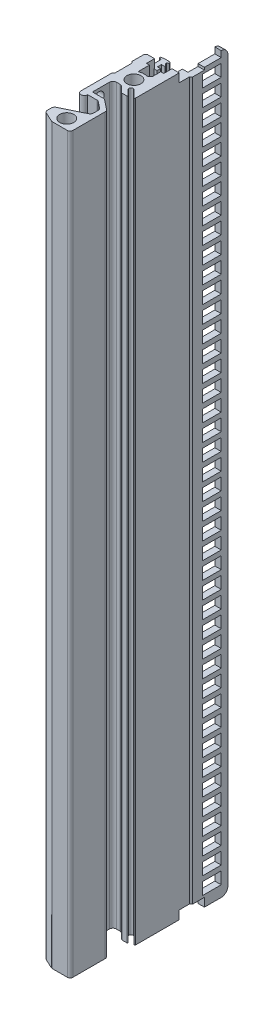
SolidWorks part; units mm, degrees
ref_plane "前视基准面" through (0, 0, 0) normal (0, 0, 1) x (1, 0, 0)
ref_plane "上视基准面" through (0, 0, 0) normal (0, 1, 0) x (1, 0, 0)
ref_plane "右视基准面" through (0, 0, 0) normal (1, 0, 0) x (0, 0, -1)
sketch "草图1" plane through (0, 0, 0) normal (0, 1, 0) x (1, 0, 0)
  line L0 (-4.2, 11.9) -> (-3.9, 11.9)
  line L1 (-4.4, 12.2) -> (-4.4, 12.1)
  line L2 (-4.0328, 12.4) -> (-4.2, 12.4)
  line L3 (-3.85, 12.5) -> (-3.8914, 12.4586)
  line L4 (-2.05, 12.5) -> (-3.85, 12.5)
  line L5 (-2.0086, 12.4586) -> (-2.05, 12.5)
  line L6 (-1.7, 12.4) -> (-1.8672, 12.4)
  line L7 (-1.5, 12.1) -> (-1.5, 12.2)
  line L8 (-1.8, 11.9) -> (-1.7, 11.9)
  line L9 (-2, 11.4828) -> (-2, 11.7)
  line L10 (-1.3586, 10.7586) -> (-1.9414, 11.3414)
  line L11 (-1.3, 10.55) -> (-1.3, 10.6172)
  line L12 (-3.7, 11.7) -> (-3.7, 9.95)
  line L13 (-5, -10.75) -> (-5, -1.6)
  line L14 (-3, -9.35) -> (-3, -5.75)
  line L16 (1.6887, -3.3855) -> (3.2118, -4.9086)
  line L17 (2.5373, -2.537) -> (4.6586, -4.6583)
  line L18 (5, 15) -> (5, 5.1793)
  line L19 (3.6, 15) -> (5, 15)
  line L20 (3.6, 12.5) -> (3.6, 15)
  line L21 (1.95, 12.5) -> (3.6, 12.5)
  line L22 (1.95, 10.55) -> (1.95, 12.5)
  line L23 (2.85, 10.55) -> (1.95, 10.55)
  line L24 (2.85, 9.35) -> (2.85, 10.55)
  line L25 (1.95, 9.35) -> (2.85, 9.35)
  line L26 (1.95, 8.35) -> (1.95, 9.35)
  line L27 (2.85, 8.35) -> (1.95, 8.35)
  line L28 (2.85, 6.05) -> (2.85, 8.35)
  line L29 (1.95, 6.05) -> (2.85, 6.05)
  line L30 (1.95, 3.8856) -> (1.95, 6.05)
  line L31 (-1.45, 6.05) -> (-1.45, 2.9458)
  line L32 (-2.35, 6.05) -> (-1.45, 6.05)
  line L33 (-2.35, 8.35) -> (-2.35, 6.05)
  line L34 (-1.45, 8.35) -> (-2.35, 8.35)
  line L35 (-1.45, 9.35) -> (-1.45, 8.35)
  line L36 (-2.35, 9.35) -> (-1.45, 9.35)
  line L37 (-2.35, 10.55) -> (-2.35, 9.35)
  line L38 (-1.3, 10.55) -> (-2.35, 10.55)
  line L39 (-4.45, 7.7) -> (-4.7, 7.7)
  line L40 (-5, 7.4) -> (-4.7, 7.7)
  line L41 (-5, 4.4) -> (-5, 7.4)
  line L42 (-4.5499, 3.8998) -> (-5, 4.4)
  line L43 (-4.45, 7.7) -> (-4.45, 9.55)
  line L44 (-3.9, 9.75) -> (-4.25, 9.75)
  line L45 (-4.5499, 3.8998) -> (-4.5501, -1.1002)
  line L46 (-5, -1.6) -> (-4.5501, -1.1002)
  line L47 (4.9414, -1.9395) -> (4.6464, -1.6446) construction
  line L48 (5, -2.081) -> (5, -4.5169)
  line L49 (0, 0) -> (0, -5) construction
  line L50 (4.5, -1.291) -> (4.5, 4.3894) construction
  line L53 (-2.5, -5.25) -> (3.0703, -5.25)
  line L54 (2.5373, -2.537) -> (1.6887, -3.3855) construction
  line L55 (5, 5.1793) -> (5, -2.081)
  line L58 (4.9414, 5.0379) -> (4.6464, 4.743) construction
  line L121 (-3, -9.35) -> (4, -9.35)
  line L122 (-4.2, -17.25) -> (2.6, -17.25)
  line L123 (-5, -22.2) -> (-5, -18.05)
  line L124 (-3, -10.75) -> (2.6, -10.75)
  line L125 (4, -9.35) -> (4, -22.2)
  line L126 (3.2, -23) -> (-4.2, -23)
  line L127 (2.6, -10.75) -> (2.6, -17.25)
  circle A0 centre (0, 0) radius 1.6
  arc A1 (-4.4, 12.1) -> (-4.2, 11.9) centre (-4.2, 12.1) ccw
  arc A2 (-4.2, 12.4) -> (-4.4, 12.2) centre (-4.2, 12.2) ccw
  arc A3 (-4.0328, 12.4) -> (-3.8914, 12.4586) centre (-4.0328, 12.6) ccw
  arc A4 (-2.0086, 12.4586) -> (-1.8672, 12.4) centre (-1.8672, 12.6) ccw
  arc A5 (-1.5, 12.2) -> (-1.7, 12.4) centre (-1.7, 12.2) ccw
  arc A6 (-1.7, 11.9) -> (-1.5, 12.1) centre (-1.7, 12.1) ccw
  arc A7 (-1.8, 11.9) -> (-2, 11.7) centre (-1.8, 11.7) ccw
  arc A8 (-2, 11.4828) -> (-1.9414, 11.3414) centre (-1.8, 11.4828) ccw
  arc A9 (-1.3, 10.6172) -> (-1.3586, 10.7586) centre (-1.5, 10.6172) ccw
  arc A11 (3.0703, -5.25) -> (3.2118, -4.9086) centre (3.0703, -5.05) ccw
  arc A12 (-4.25, 9.75) -> (-4.45, 9.55) centre (-4.25, 9.55) ccw
  arc A13 (-3.9, 9.75) -> (-3.7, 9.95) centre (-3.9, 9.95) ccw
  arc A14 (5, -2.081) -> (4.9414, -1.9395) centre (4.8, -2.081) ccw construction
  arc A15 (4.9414, 5.0379) -> (5, 5.1793) centre (4.8, 5.1793) ccw construction
  arc A16 (4.6586, -4.6583) -> (5, -4.5169) centre (4.8, -4.5169) ccw
  arc A17 (2.5373, -2.537) -> (1.6887, -3.3855) centre (2.113, -2.9613) ccw
  arc A18 (0.7125, 2.9142) -> (-1.1719, 2.7616) centre (0, 0) ccw
  arc A19 (-1.45, 2.9458) -> (-1.1719, 2.7616) centre (-1.25, 2.9458) ccw
  arc A20 (0.7125, 2.9142) -> (1.95, 3.8856) centre (0.95, 3.8856) ccw
  arc A21 (-3.7, 11.7) -> (-3.9, 11.9) centre (-3.9, 11.7) ccw
  arc A22 (4.6464, -1.6446) -> (4.5, -1.291) centre (5, -1.291) cw construction
  arc A23 (4.5, 4.3894) -> (4.6464, 4.743) centre (5, 4.3894) cw construction
  arc A29 (-3, -5.75) -> (-2.5, -5.25) centre (-2.5, -5.75) cw
  arc A60 (-5, -22.2) -> (-4.2, -23) centre (-4.2, -22.2) ccw
  circle A61 centre (0, -20) radius 1.6
  arc A62 (-4.2, -17.25) -> (-5, -18.05) centre (-4.2, -18.05) ccw
  arc A63 (-5, -10.75) -> (-3, -10.75) centre (-4, -10.75) ccw
  arc A64 (3.2, -23) -> (4, -22.2) centre (3.2, -22.2) ccw
  dimension "D1" = 3.2
  dimension "D3" = 5.2
  dimension "D4" = 45
  dimension "D5" = 1.2
  dimension "D7" = 0.6
  dimension "D8" = 0.2
  dimension "D10" = 4.1
  dimension "D11" = 1.4
  dimension "D12" = 0.5
  dimension "D13" = 0.5
  dimension "D14" = 1
  dimension "D33" = 3.2
  dimension "D34" = 20
  dimension "D37" = 0.8
  dimension "D38" = 0.8
  dimension "D39" = 0.8
  dimension "D6" = 3
  dimension "D9" = 2.1225
  dimension "D28" = 38
  dimension "D29" = 13.65
  dimension "D30" = 1
  dimension "D31" = 9
  dimension "D32" = 5.75
  dimension "D36" = 6.5
extrude "凸台-拉伸1" add sketch "草图1" along normal mid plane 218.44
sketch "草图6" plane through (0, 109.22, 0) normal (0, 1, 0) x (1, 0, 0)
  line L0 (3.6, 12.5) -> (3.6, 22.5)
  line L1 (3.6, 22.5) -> (5.5, 22.5)
  line L2 (5.5, 22.5) -> (5.5, 12)
  line L3 (5.5, 12) -> (5, 11.5)
  line L4 (3.6, 12.5) -> (5, 11.5)
  line L5 (5, -4.5169) -> (5, 15) construction
  line L6 (-5, 7.4) -> (-5, 4.4) construction
  dimension "D4" = 11
  dimension "D1" = 10.5
  dimension "D2" = 10
  dimension "D3" = 45
extrude "凸台-拉伸2" add sketch "草图6" against normal up to surface (218.44 mm away)
sketch "草图2" plane through (0, 109.22, 0) normal (0, 1, 0) x (1, 0, 0)
  circle A0 centre (0, 0) radius 2.1
  circle A1 centre (0, -20) radius 2.1
  dimension "D1" = 4.2
  dimension "D2" = 4.2
extrude "切除-拉伸1" cut sketch "草图2" against normal blind 10
sketch "草图3" plane through (0, -109.22, 0) normal (0, -1, 0) x (1, 0, 0)
  circle A0 centre (0, 0) radius 2.1
  circle A1 centre (0, 20) radius 2.1
  dimension "D1" = 4.2
  dimension "D2" = 4.2
extrude "切除-拉伸2" cut sketch "草图3" against normal blind 10
sketch "草图4" plane through (-5, 0, 0) normal (-1, 0, 0) x (0, 0, 1)
  line L0 (1.6, -109.22) -> (10.75, -109.22) construction
  line L2 (11.75, -109.22) -> (11.75, 109.22) construction
  circle A0 centre (7.5, -106.68) radius 1.65
  circle A1 centre (7.5, -101.6) radius 1.65
  circle A2 centre (7.5, -96.52) radius 1.65
  circle A3 centre (7.5, -91.44) radius 1.65
  circle A4 centre (7.5, -86.36) radius 1.65
  circle A5 centre (7.5, -81.28) radius 1.65
  circle A6 centre (7.5, -76.2) radius 1.65
  circle A7 centre (7.5, -71.12) radius 1.65
  circle A8 centre (7.5, -66.04) radius 1.65
  circle A9 centre (7.5, -60.96) radius 1.65
  circle A10 centre (7.5, -55.88) radius 1.65
  circle A11 centre (7.5, -50.8) radius 1.65
  circle A12 centre (7.5, -45.72) radius 1.65
  circle A13 centre (7.5, -40.64) radius 1.65
  circle A14 centre (7.5, -35.56) radius 1.65
  circle A15 centre (7.5, -30.48) radius 1.65
  circle A16 centre (7.5, -25.4) radius 1.65
  circle A17 centre (7.5, -20.32) radius 1.65
  circle A18 centre (7.5, -15.24) radius 1.65
  circle A19 centre (7.5, -10.16) radius 1.65
  circle A20 centre (7.5, -5.08) radius 1.65
  circle A21 centre (7.5, 0) radius 1.65
  circle A22 centre (7.5, 5.08) radius 1.65
  circle A23 centre (7.5, 10.16) radius 1.65
  circle A24 centre (7.5, 15.24) radius 1.65
  circle A25 centre (7.5, 20.32) radius 1.65
  circle A26 centre (7.5, 25.4) radius 1.65
  circle A27 centre (7.5, 30.48) radius 1.65
  circle A28 centre (7.5, 35.56) radius 1.65
  circle A29 centre (7.5, 40.64) radius 1.65
  circle A30 centre (7.5, 45.72) radius 1.65
  circle A31 centre (7.5, 50.8) radius 1.65
  circle A32 centre (7.5, 55.88) radius 1.65
  circle A33 centre (7.5, 60.96) radius 1.65
  circle A34 centre (7.5, 66.04) radius 1.65
  circle A35 centre (7.5, 71.12) radius 1.65
  circle A36 centre (7.5, 76.2) radius 1.65
  circle A37 centre (7.5, 81.28) radius 1.65
  circle A38 centre (7.5, 86.36) radius 1.65
  circle A39 centre (7.5, 91.44) radius 1.65
  circle A40 centre (7.5, 96.52) radius 1.65
  circle A41 centre (7.5, 101.6) radius 1.65
  circle A42 centre (7.5, 106.68) radius 1.65
  circle A43 centre (7.5, 111.76) radius 1.65
  circle A44 centre (7.5, 116.84) radius 1.65
  circle A45 centre (7.5, 121.92) radius 1.65
  circle A46 centre (7.5, 127) radius 1.65
  circle A47 centre (7.5, 132.08) radius 1.65
  circle A48 centre (7.5, 137.16) radius 1.65
  circle A49 centre (7.5, 142.24) radius 1.65
  circle A50 centre (7.5, 147.32) radius 1.65
  circle A51 centre (7.5, 152.4) radius 1.65
  circle A52 centre (7.5, 157.48) radius 1.65
  circle A53 centre (7.5, 162.56) radius 1.65
  circle A54 centre (7.5, 167.64) radius 1.65
  circle A55 centre (7.5, 172.72) radius 1.65
  circle A56 centre (7.5, 177.8) radius 1.65
  circle A57 centre (7.5, 182.88) radius 1.65
  circle A58 centre (7.5, 187.96) radius 1.65
  circle A59 centre (7.5, 193.04) radius 1.65
  circle A60 centre (7.5, 198.12) radius 1.65
  circle A61 centre (7.5, 203.2) radius 1.65
  circle A62 centre (7.5, 208.28) radius 1.65
  circle A63 centre (7.5, 213.36) radius 1.65
  circle A64 centre (7.5, 218.44) radius 1.65
  circle A65 centre (7.5, 223.52) radius 1.65
  circle A66 centre (7.5, 228.6) radius 1.65
  circle A67 centre (7.5, 233.68) radius 1.65
  circle A68 centre (7.5, 238.76) radius 1.65
  circle A69 centre (7.5, 243.84) radius 1.65
  circle A70 centre (7.5, 248.92) radius 1.65
  circle A71 centre (7.5, 254) radius 1.65
  circle A72 centre (7.5, 259.08) radius 1.65
  circle A73 centre (7.5, 264.16) radius 1.65
  circle A74 centre (7.5, 269.24) radius 1.65
  circle A75 centre (7.5, 274.32) radius 1.65
  circle A76 centre (7.5, 279.4) radius 1.65
  circle A77 centre (7.5, 284.48) radius 1.65
  circle A78 centre (7.5, 289.56) radius 1.65
  circle A79 centre (7.5, 294.64) radius 1.65
  circle A80 centre (7.5, 299.72) radius 1.65
  circle A81 centre (7.5, 304.8) radius 1.65
  circle A82 centre (7.5, 309.88) radius 1.65
  circle A83 centre (7.5, 314.96) radius 1.65
  circle A84 centre (7.5, 320.04) radius 1.65
  dimension "D1" = 2.54
  dimension "D2" = 4.25
  dimension "D3" = 3.3
  dimension "D5" = 5.08
  dimension "D4" = 85
extrude "切除-拉伸3" cut sketch "草图4" against normal blind 12
sketch "草图5" plane through (5.5, 0, 0) normal (1, 0, 0) x (0, 0, -1)
  line L0 (-19.1753, 0) -> (41.1348, 0) construction
  line L1 (15.5, 109.22) -> (8.5, 109.22)
  line L2 (15.5, 109.22) -> (15.5, 106.68)
  line L3 (15.5, 106.68) -> (8.5, 106.68)
  line L4 (8.5, 109.22) -> (8.5, 106.68)
  line L6 (8.5, -109.22) -> (8.5, -106.68)
  line L7 (15.5, -106.68) -> (8.5, -106.68)
  line L8 (15.5, -109.22) -> (15.5, -106.68)
  line L9 (15.5, -109.22) -> (8.5, -109.22)
  line L10 (12, 109.22) -> (22.5, 109.22) construction
  line L11 (22.5, -109.22) -> (22.5, 109.22) construction
  dimension "D1" = 7
  dimension "D2" = 2.54
  dimension "D3" = 7
extrude "切除-拉伸4" cut sketch "草图5" against normal through all
sketch "草图7" plane through (5.5, 0, 0) normal (1, 0, 0) x (0, 0, -1)
  line L0 (22.5, -109.22) -> (22.5, 109.22) construction
  line L1 (15, -105.94) -> (20.5, -105.94)
  line L2 (15, -105.94) -> (15, -102.34)
  line L3 (15, -102.34) -> (20.5, -102.34)
  line L4 (20.5, -105.94) -> (20.5, -102.34)
  line L5 (22.5, -109.22) -> (15.5, -109.22) construction
  line L6 (15, -100.86) -> (20.5, -100.86)
  line L7 (15, -100.86) -> (15, -97.26)
  line L8 (15, -97.26) -> (20.5, -97.26)
  line L9 (20.5, -100.86) -> (20.5, -97.26)
  line L10 (15, -95.78) -> (20.5, -95.78)
  line L11 (15, -95.78) -> (15, -92.18)
  line L12 (15, -92.18) -> (20.5, -92.18)
  line L13 (20.5, -95.78) -> (20.5, -92.18)
  line L14 (15, -90.7) -> (20.5, -90.7)
  line L15 (15, -90.7) -> (15, -87.1)
  line L16 (15, -87.1) -> (20.5, -87.1)
  line L17 (20.5, -90.7) -> (20.5, -87.1)
  line L18 (15, -85.62) -> (20.5, -85.62)
  line L19 (15, -85.62) -> (15, -82.02)
  line L20 (15, -82.02) -> (20.5, -82.02)
  line L21 (20.5, -85.62) -> (20.5, -82.02)
  line L22 (15, -80.54) -> (20.5, -80.54)
  line L23 (15, -80.54) -> (15, -76.94)
  line L24 (15, -76.94) -> (20.5, -76.94)
  line L25 (20.5, -80.54) -> (20.5, -76.94)
  line L26 (15, -75.46) -> (20.5, -75.46)
  line L27 (15, -75.46) -> (15, -71.86)
  line L28 (15, -71.86) -> (20.5, -71.86)
  line L29 (20.5, -75.46) -> (20.5, -71.86)
  line L30 (15, -70.38) -> (20.5, -70.38)
  line L31 (15, -70.38) -> (15, -66.78)
  line L32 (15, -66.78) -> (20.5, -66.78)
  line L33 (20.5, -70.38) -> (20.5, -66.78)
  line L34 (15, -65.3) -> (20.5, -65.3)
  line L35 (15, -65.3) -> (15, -61.7)
  line L36 (15, -61.7) -> (20.5, -61.7)
  line L37 (20.5, -65.3) -> (20.5, -61.7)
  line L38 (15, -60.22) -> (20.5, -60.22)
  line L39 (15, -60.22) -> (15, -56.62)
  line L40 (15, -56.62) -> (20.5, -56.62)
  line L41 (20.5, -60.22) -> (20.5, -56.62)
  line L42 (15, -55.14) -> (20.5, -55.14)
  line L43 (15, -55.14) -> (15, -51.54)
  line L44 (15, -51.54) -> (20.5, -51.54)
  line L45 (20.5, -55.14) -> (20.5, -51.54)
  line L46 (15, -50.06) -> (20.5, -50.06)
  line L47 (15, -50.06) -> (15, -46.46)
  line L48 (15, -46.46) -> (20.5, -46.46)
  line L49 (20.5, -50.06) -> (20.5, -46.46)
  line L50 (15, -44.98) -> (20.5, -44.98)
  line L51 (15, -44.98) -> (15, -41.38)
  line L52 (15, -41.38) -> (20.5, -41.38)
  line L53 (20.5, -44.98) -> (20.5, -41.38)
  line L54 (15, -39.9) -> (20.5, -39.9)
  line L55 (15, -39.9) -> (15, -36.3)
  line L56 (15, -36.3) -> (20.5, -36.3)
  line L57 (20.5, -39.9) -> (20.5, -36.3)
  line L58 (15, -34.82) -> (20.5, -34.82)
  line L59 (15, -34.82) -> (15, -31.22)
  line L60 (15, -31.22) -> (20.5, -31.22)
  line L61 (20.5, -34.82) -> (20.5, -31.22)
  line L62 (15, -29.74) -> (20.5, -29.74)
  line L63 (15, -29.74) -> (15, -26.14)
  line L64 (15, -26.14) -> (20.5, -26.14)
  line L65 (20.5, -29.74) -> (20.5, -26.14)
  line L66 (15, -24.66) -> (20.5, -24.66)
  line L67 (15, -24.66) -> (15, -21.06)
  line L68 (15, -21.06) -> (20.5, -21.06)
  line L69 (20.5, -24.66) -> (20.5, -21.06)
  line L70 (15, -19.58) -> (20.5, -19.58)
  line L71 (15, -19.58) -> (15, -15.98)
  line L72 (15, -15.98) -> (20.5, -15.98)
  line L73 (20.5, -19.58) -> (20.5, -15.98)
  line L74 (15, -14.5) -> (20.5, -14.5)
  line L75 (15, -14.5) -> (15, -10.9)
  line L76 (15, -10.9) -> (20.5, -10.9)
  line L77 (20.5, -14.5) -> (20.5, -10.9)
  line L78 (15, -9.42) -> (20.5, -9.42)
  line L79 (15, -9.42) -> (15, -5.82)
  line L80 (15, -5.82) -> (20.5, -5.82)
  line L81 (20.5, -9.42) -> (20.5, -5.82)
  line L82 (15, -4.34) -> (20.5, -4.34)
  line L83 (15, -4.34) -> (15, -0.74)
  line L84 (15, -0.74) -> (20.5, -0.74)
  line L85 (20.5, -4.34) -> (20.5, -0.74)
  line L86 (15, 0.74) -> (20.5, 0.74)
  line L87 (15, 0.74) -> (15, 4.34)
  line L88 (15, 4.34) -> (20.5, 4.34)
  line L89 (20.5, 0.74) -> (20.5, 4.34)
  line L90 (15, 5.82) -> (20.5, 5.82)
  line L91 (15, 5.82) -> (15, 9.42)
  line L92 (15, 9.42) -> (20.5, 9.42)
  line L93 (20.5, 5.82) -> (20.5, 9.42)
  line L94 (15, 10.9) -> (20.5, 10.9)
  line L95 (15, 10.9) -> (15, 14.5)
  line L96 (15, 14.5) -> (20.5, 14.5)
  line L97 (20.5, 10.9) -> (20.5, 14.5)
  line L98 (15, 15.98) -> (20.5, 15.98)
  line L99 (15, 15.98) -> (15, 19.58)
  line L100 (15, 19.58) -> (20.5, 19.58)
  line L101 (20.5, 15.98) -> (20.5, 19.58)
  line L102 (15, 21.06) -> (20.5, 21.06)
  line L103 (15, 21.06) -> (15, 24.66)
  line L104 (15, 24.66) -> (20.5, 24.66)
  line L105 (20.5, 21.06) -> (20.5, 24.66)
  line L106 (15, 26.14) -> (20.5, 26.14)
  line L107 (15, 26.14) -> (15, 29.74)
  line L108 (15, 29.74) -> (20.5, 29.74)
  line L109 (20.5, 26.14) -> (20.5, 29.74)
  line L110 (15, 31.22) -> (20.5, 31.22)
  line L111 (15, 31.22) -> (15, 34.82)
  line L112 (15, 34.82) -> (20.5, 34.82)
  line L113 (20.5, 31.22) -> (20.5, 34.82)
  line L114 (15, 36.3) -> (20.5, 36.3)
  line L115 (15, 36.3) -> (15, 39.9)
  line L116 (15, 39.9) -> (20.5, 39.9)
  line L117 (20.5, 36.3) -> (20.5, 39.9)
  line L118 (15, 41.38) -> (20.5, 41.38)
  line L119 (15, 41.38) -> (15, 44.98)
  line L120 (15, 44.98) -> (20.5, 44.98)
  line L121 (20.5, 41.38) -> (20.5, 44.98)
  line L122 (15, 46.46) -> (20.5, 46.46)
  line L123 (15, 46.46) -> (15, 50.06)
  line L124 (15, 50.06) -> (20.5, 50.06)
  line L125 (20.5, 46.46) -> (20.5, 50.06)
  line L126 (15, 51.54) -> (20.5, 51.54)
  line L127 (15, 51.54) -> (15, 55.14)
  line L128 (15, 55.14) -> (20.5, 55.14)
  line L129 (20.5, 51.54) -> (20.5, 55.14)
  line L130 (15, 56.62) -> (20.5, 56.62)
  line L131 (15, 56.62) -> (15, 60.22)
  line L132 (15, 60.22) -> (20.5, 60.22)
  line L133 (20.5, 56.62) -> (20.5, 60.22)
  line L134 (15, 61.7) -> (20.5, 61.7)
  line L135 (15, 61.7) -> (15, 65.3)
  line L136 (15, 65.3) -> (20.5, 65.3)
  line L137 (20.5, 61.7) -> (20.5, 65.3)
  line L138 (15, 66.78) -> (20.5, 66.78)
  line L139 (15, 66.78) -> (15, 70.38)
  line L140 (15, 70.38) -> (20.5, 70.38)
  line L141 (20.5, 66.78) -> (20.5, 70.38)
  line L142 (15, 71.86) -> (20.5, 71.86)
  line L143 (15, 71.86) -> (15, 75.46)
  line L144 (15, 75.46) -> (20.5, 75.46)
  line L145 (20.5, 71.86) -> (20.5, 75.46)
  line L146 (15, 76.94) -> (20.5, 76.94)
  line L147 (15, 76.94) -> (15, 80.54)
  line L148 (15, 80.54) -> (20.5, 80.54)
  line L149 (20.5, 76.94) -> (20.5, 80.54)
  line L150 (15, 82.02) -> (20.5, 82.02)
  line L151 (15, 82.02) -> (15, 85.62)
  line L152 (15, 85.62) -> (20.5, 85.62)
  line L153 (20.5, 82.02) -> (20.5, 85.62)
  line L154 (15, 87.1) -> (20.5, 87.1)
  line L155 (15, 87.1) -> (15, 90.7)
  line L156 (15, 90.7) -> (20.5, 90.7)
  line L157 (20.5, 87.1) -> (20.5, 90.7)
  line L158 (15, 92.18) -> (20.5, 92.18)
  line L159 (15, 92.18) -> (15, 95.78)
  line L160 (15, 95.78) -> (20.5, 95.78)
  line L161 (20.5, 92.18) -> (20.5, 95.78)
  line L162 (15, 97.26) -> (20.5, 97.26)
  line L163 (15, 97.26) -> (15, 100.86)
  line L164 (15, 100.86) -> (20.5, 100.86)
  line L165 (20.5, 97.26) -> (20.5, 100.86)
  line L166 (15, 102.34) -> (20.5, 102.34)
  line L167 (15, 102.34) -> (15, 105.94)
  line L168 (15, 105.94) -> (20.5, 105.94)
  line L169 (20.5, 102.34) -> (20.5, 105.94)
  line L170 (15, 107.42) -> (20.5, 107.42)
  line L171 (15, 107.42) -> (15, 111.02)
  line L172 (15, 111.02) -> (20.5, 111.02)
  line L173 (20.5, 107.42) -> (20.5, 111.02)
  line L174 (15, 112.5) -> (20.5, 112.5)
  line L175 (15, 112.5) -> (15, 116.1)
  line L176 (15, 116.1) -> (20.5, 116.1)
  line L177 (20.5, 112.5) -> (20.5, 116.1)
  line L178 (15, 117.58) -> (20.5, 117.58)
  line L179 (15, 117.58) -> (15, 121.18)
  line L180 (15, 121.18) -> (20.5, 121.18)
  line L181 (20.5, 117.58) -> (20.5, 121.18)
  line L182 (15, 122.66) -> (20.5, 122.66)
  line L183 (15, 122.66) -> (15, 126.26)
  line L184 (15, 126.26) -> (20.5, 126.26)
  line L185 (20.5, 122.66) -> (20.5, 126.26)
  line L186 (15, 127.74) -> (20.5, 127.74)
  line L187 (15, 127.74) -> (15, 131.34)
  line L188 (15, 131.34) -> (20.5, 131.34)
  line L189 (20.5, 127.74) -> (20.5, 131.34)
  line L190 (15, 132.82) -> (20.5, 132.82)
  line L191 (15, 132.82) -> (15, 136.42)
  line L192 (15, 136.42) -> (20.5, 136.42)
  line L193 (20.5, 132.82) -> (20.5, 136.42)
  line L194 (15, 137.9) -> (20.5, 137.9)
  line L195 (15, 137.9) -> (15, 141.5)
  line L196 (15, 141.5) -> (20.5, 141.5)
  line L197 (20.5, 137.9) -> (20.5, 141.5)
  line L198 (15, 142.98) -> (20.5, 142.98)
  line L199 (15, 142.98) -> (15, 146.58)
  line L200 (15, 146.58) -> (20.5, 146.58)
  line L201 (20.5, 142.98) -> (20.5, 146.58)
  line L202 (15, 148.06) -> (20.5, 148.06)
  line L203 (15, 148.06) -> (15, 151.66)
  line L204 (15, 151.66) -> (20.5, 151.66)
  line L205 (20.5, 148.06) -> (20.5, 151.66)
  line L206 (15, 153.14) -> (20.5, 153.14)
  line L207 (15, 153.14) -> (15, 156.74)
  line L208 (15, 156.74) -> (20.5, 156.74)
  line L209 (20.5, 153.14) -> (20.5, 156.74)
  line L210 (15, 158.22) -> (20.5, 158.22)
  line L211 (15, 158.22) -> (15, 161.82)
  line L212 (15, 161.82) -> (20.5, 161.82)
  line L213 (20.5, 158.22) -> (20.5, 161.82)
  line L214 (15, 163.3) -> (20.5, 163.3)
  line L215 (15, 163.3) -> (15, 166.9)
  line L216 (15, 166.9) -> (20.5, 166.9)
  line L217 (20.5, 163.3) -> (20.5, 166.9)
  line L218 (15, 168.38) -> (20.5, 168.38)
  line L219 (15, 168.38) -> (15, 171.98)
  line L220 (15, 171.98) -> (20.5, 171.98)
  line L221 (20.5, 168.38) -> (20.5, 171.98)
  line L222 (15, 173.46) -> (20.5, 173.46)
  line L223 (15, 173.46) -> (15, 177.06)
  line L224 (15, 177.06) -> (20.5, 177.06)
  line L225 (20.5, 173.46) -> (20.5, 177.06)
  line L226 (15, 178.54) -> (20.5, 178.54)
  line L227 (15, 178.54) -> (15, 182.14)
  line L228 (15, 182.14) -> (20.5, 182.14)
  line L229 (20.5, 178.54) -> (20.5, 182.14)
  line L230 (15, 183.62) -> (20.5, 183.62)
  line L231 (15, 183.62) -> (15, 187.22)
  line L232 (15, 187.22) -> (20.5, 187.22)
  line L233 (20.5, 183.62) -> (20.5, 187.22)
  line L234 (15, 188.7) -> (20.5, 188.7)
  line L235 (15, 188.7) -> (15, 192.3)
  line L236 (15, 192.3) -> (20.5, 192.3)
  line L237 (20.5, 188.7) -> (20.5, 192.3)
  line L238 (15, 193.78) -> (20.5, 193.78)
  line L239 (15, 193.78) -> (15, 197.38)
  line L240 (15, 197.38) -> (20.5, 197.38)
  line L241 (20.5, 193.78) -> (20.5, 197.38)
  line L242 (15, 198.86) -> (20.5, 198.86)
  line L243 (15, 198.86) -> (15, 202.46)
  line L244 (15, 202.46) -> (20.5, 202.46)
  line L245 (20.5, 198.86) -> (20.5, 202.46)
  line L246 (15, 203.94) -> (20.5, 203.94)
  line L247 (15, 203.94) -> (15, 207.54)
  line L248 (15, 207.54) -> (20.5, 207.54)
  line L249 (20.5, 203.94) -> (20.5, 207.54)
  line L250 (15, 209.02) -> (20.5, 209.02)
  line L251 (15, 209.02) -> (15, 212.62)
  line L252 (15, 212.62) -> (20.5, 212.62)
  line L253 (20.5, 209.02) -> (20.5, 212.62)
  line L254 (15, 214.1) -> (20.5, 214.1)
  line L255 (15, 214.1) -> (15, 217.7)
  line L256 (15, 217.7) -> (20.5, 217.7)
  line L257 (20.5, 214.1) -> (20.5, 217.7)
  line L258 (15, 219.18) -> (20.5, 219.18)
  line L259 (15, 219.18) -> (15, 222.78)
  line L260 (15, 222.78) -> (20.5, 222.78)
  line L261 (20.5, 219.18) -> (20.5, 222.78)
  line L262 (15, 224.26) -> (20.5, 224.26)
  line L263 (15, 224.26) -> (15, 227.86)
  line L264 (15, 227.86) -> (20.5, 227.86)
  line L265 (20.5, 224.26) -> (20.5, 227.86)
  line L266 (15, 229.34) -> (20.5, 229.34)
  line L267 (15, 229.34) -> (15, 232.94)
  line L268 (15, 232.94) -> (20.5, 232.94)
  line L269 (20.5, 229.34) -> (20.5, 232.94)
  line L270 (15, 234.42) -> (20.5, 234.42)
  line L271 (15, 234.42) -> (15, 238.02)
  line L272 (15, 238.02) -> (20.5, 238.02)
  line L273 (20.5, 234.42) -> (20.5, 238.02)
  line L274 (15, 239.5) -> (20.5, 239.5)
  line L275 (15, 239.5) -> (15, 243.1)
  line L276 (15, 243.1) -> (20.5, 243.1)
  line L277 (20.5, 239.5) -> (20.5, 243.1)
  line L278 (15, 244.58) -> (20.5, 244.58)
  line L279 (15, 244.58) -> (15, 248.18)
  line L280 (15, 248.18) -> (20.5, 248.18)
  line L281 (20.5, 244.58) -> (20.5, 248.18)
  line L282 (15, 249.66) -> (20.5, 249.66)
  line L283 (15, 249.66) -> (15, 253.26)
  line L284 (15, 253.26) -> (20.5, 253.26)
  line L285 (20.5, 249.66) -> (20.5, 253.26)
  line L286 (15, 254.74) -> (20.5, 254.74)
  line L287 (15, 254.74) -> (15, 258.34)
  line L288 (15, 258.34) -> (20.5, 258.34)
  line L289 (20.5, 254.74) -> (20.5, 258.34)
  line L290 (15, 259.82) -> (20.5, 259.82)
  line L291 (15, 259.82) -> (15, 263.42)
  line L292 (15, 263.42) -> (20.5, 263.42)
  line L293 (20.5, 259.82) -> (20.5, 263.42)
  line L294 (15, 264.9) -> (20.5, 264.9)
  line L295 (15, 264.9) -> (15, 268.5)
  line L296 (15, 268.5) -> (20.5, 268.5)
  line L297 (20.5, 264.9) -> (20.5, 268.5)
  line L298 (15, 269.98) -> (20.5, 269.98)
  line L299 (15, 269.98) -> (15, 273.58)
  line L300 (15, 273.58) -> (20.5, 273.58)
  line L301 (20.5, 269.98) -> (20.5, 273.58)
  line L302 (15, 275.06) -> (20.5, 275.06)
  line L303 (15, 275.06) -> (15, 278.66)
  line L304 (15, 278.66) -> (20.5, 278.66)
  line L305 (20.5, 275.06) -> (20.5, 278.66)
  line L306 (15, 280.14) -> (20.5, 280.14)
  line L307 (15, 280.14) -> (15, 283.74)
  line L308 (15, 283.74) -> (20.5, 283.74)
  line L309 (20.5, 280.14) -> (20.5, 283.74)
  line L310 (15, 285.22) -> (20.5, 285.22)
  line L311 (15, 285.22) -> (15, 288.82)
  line L312 (15, 288.82) -> (20.5, 288.82)
  line L313 (20.5, 285.22) -> (20.5, 288.82)
  line L314 (15, 290.3) -> (20.5, 290.3)
  line L315 (15, 290.3) -> (15, 293.9)
  line L316 (15, 293.9) -> (20.5, 293.9)
  line L317 (20.5, 290.3) -> (20.5, 293.9)
  line L318 (15, 295.38) -> (20.5, 295.38)
  line L319 (15, 295.38) -> (15, 298.98)
  line L320 (15, 298.98) -> (20.5, 298.98)
  line L321 (20.5, 295.38) -> (20.5, 298.98)
  line L322 (15, 300.46) -> (20.5, 300.46)
  line L323 (15, 300.46) -> (15, 304.06)
  line L324 (15, 304.06) -> (20.5, 304.06)
  line L325 (20.5, 300.46) -> (20.5, 304.06)
  line L326 (15, 305.54) -> (20.5, 305.54)
  line L327 (15, 305.54) -> (15, 309.14)
  line L328 (15, 309.14) -> (20.5, 309.14)
  line L329 (20.5, 305.54) -> (20.5, 309.14)
  line L330 (15, 310.62) -> (20.5, 310.62)
  line L331 (15, 310.62) -> (15, 314.22)
  line L332 (15, 314.22) -> (20.5, 314.22)
  line L333 (20.5, 310.62) -> (20.5, 314.22)
  line L334 (15, 315.7) -> (20.5, 315.7)
  line L335 (15, 315.7) -> (15, 319.3)
  line L336 (15, 319.3) -> (20.5, 319.3)
  line L337 (20.5, 315.7) -> (20.5, 319.3)
  dimension "D1" = 3.6
  dimension "D2" = 5.5
  dimension "D3" = 2
  dimension "D4" = 3.28
  dimension "D5" = 84
extrude "切除-拉伸5" cut sketch "草图7" against normal blind 10
fillet "圆角1" radius 2 2 edges at (4.55, -109.22, -22.5) (4.55, 109.22, -22.5)
sketch "草图8" plane through (0, -109.22, 0) normal (0, -1, 0) x (1, 0, 0)
  line L0 (-4.45, -8.5) -> (-5, -8.5)
  line L1 (-4.45, -8.5) -> (-4.45, -7.7)
  line L3 (-4.45, -7.7) -> (-4.7, -7.7)
  line L4 (-4.7, -7.7) -> (-5, -7.4)
  line L5 (-5, -7.4) -> (-5, -8.5)
extrude "凸台-拉伸3" add sketch "草图8" against normal through all
chamfer "倒角1" distance 0.55 angle 45 1 edges at (-5, 0, -8.5)
sketch "草图9" plane through (0, 0, -8.5) normal (0, 0, -1) x (-1, 0, 0)
  line L0 (4.45, 106.68) -> (1.45, 106.68) construction
  line L1 (1.45, 109.22) -> (2.35, 109.22)
  line L2 (1.45, 109.22) -> (1.45, 106.68)
  line L3 (1.45, 106.68) -> (2.35, 106.68)
  line L4 (2.35, 109.22) -> (2.35, 106.68)
  line L5 (2.35, 109.22) -> (2.35, -109.22) construction
  line L6 (-1.95, 106.68) -> (-5, 106.68) construction
  line L7 (-1.95, 109.22) -> (-2.85, 109.22)
  line L8 (-1.95, 109.22) -> (-1.95, 106.68)
  line L9 (-1.95, 106.68) -> (-2.85, 106.68)
  line L10 (-2.85, 109.22) -> (-2.85, 106.68)
  line L11 (-2.85, 109.22) -> (-2.85, -109.22) construction
  line L12 (5, 0) -> (-5.5, 0) construction
  line L13 (5, 109.22) -> (5, -109.22) construction
  line L14 (-5.5, -107.22) -> (-5.5, 107.22) construction
  line L15 (-2.85, -109.22) -> (-2.85, -106.68)
  line L16 (-1.95, -106.68) -> (-2.85, -106.68)
  line L17 (-1.95, -109.22) -> (-1.95, -106.68)
  line L18 (-1.95, -109.22) -> (-2.85, -109.22)
  line L19 (2.35, -109.22) -> (2.35, -106.68)
  line L20 (1.45, -106.68) -> (2.35, -106.68)
  line L21 (1.45, -109.22) -> (1.45, -106.68)
  line L22 (1.45, -109.22) -> (2.35, -109.22)
extrude "切除-拉伸6" cut sketch "草图9" against normal up to surface (0.15 mm away)
sketch "草图10" plane through (0, 109.22, 0) normal (0, 1, 0) x (1, 0, 0)
  line L0 (-5, -19.75) -> (-1, -23)
  line L1 (-5, -18.05) -> (-5, -22.2) construction
  line L2 (-4.2, -23) -> (3.2, -23) construction
  line L3 (-1, -23) -> (-5, -23)
  line L4 (-5, -23) -> (-5, -19.75)
  line L5 (2.6, -17.25) -> (-4.2, -17.25) construction
  dimension "D1" = 2.5
  dimension "D2" = 4
extrude "切除-拉伸7" [suppressed] cut sketch "草图10" against normal through all
fillet "圆角2" [suppressed] radius 0.8
sketch "草图11" plane through (-5, 0, 0) normal (-1, 0, 0) x (0, 0, 1)
  line L0 (-4.4, 109.22) -> (-4.4, -109.22) construction
  line L1 (-4.4, 66.29) -> (-7.95, 66.29)
  line L2 (-4.4, 66.29) -> (-4.4, 65.79)
  line L3 (-4.4, 65.79) -> (-7.95, 65.79)
  line L4 (-7.95, 66.29) -> (-7.95, 65.79)
  line L5 (-4.4, 66.29) -> (-7.95, 65.79) construction
  line L6 (-4.4, 65.79) -> (-7.95, 66.29) construction
  line L7 (-7.95, 109.22) -> (-7.95, -109.22) construction
  line L8 (-9.95, 106.68) -> (-11.7, 106.68) construction
  line L9 (-4.4, 25.65) -> (-4.4, 25.15)
  line L10 (-4.4, 25.65) -> (-7.95, 25.65)
  line L11 (-4.4, 25.15) -> (-7.95, 25.65) construction
  line L12 (-4.4, 25.65) -> (-7.95, 25.15) construction
  line L13 (-4.4, 25.15) -> (-7.95, 25.15)
  line L14 (-7.95, 25.65) -> (-7.95, 25.15)
  line L15 (-4.4, -14.99) -> (-4.4, -15.49)
  line L16 (-4.4, -14.99) -> (-7.95, -14.99)
  line L17 (-4.4, -15.49) -> (-7.95, -14.99) construction
  line L18 (-4.4, -14.99) -> (-7.95, -15.49) construction
  line L19 (-4.4, -15.49) -> (-7.95, -15.49)
  line L20 (-7.95, -14.99) -> (-7.95, -15.49)
  line L21 (-4.4, -55.63) -> (-4.4, -56.13)
  line L22 (-4.4, -55.63) -> (-7.95, -55.63)
  line L23 (-4.4, -56.13) -> (-7.95, -55.63) construction
  line L24 (-4.4, -55.63) -> (-7.95, -56.13) construction
  line L25 (-4.4, -56.13) -> (-7.95, -56.13)
  line L26 (-7.95, -55.63) -> (-7.95, -56.13)
  line L27 (-4.4, -96.27) -> (-4.4, -96.77)
  line L28 (-4.4, -96.27) -> (-7.95, -96.27)
  line L29 (-4.4, -96.77) -> (-7.95, -96.27) construction
  line L30 (-4.4, -96.27) -> (-7.95, -96.77) construction
  line L31 (-4.4, -96.77) -> (-7.95, -96.77)
  line L32 (-7.95, -96.27) -> (-7.95, -96.77)
  line L33 (-4.4, -136.91) -> (-4.4, -137.41)
  line L34 (-4.4, -136.91) -> (-7.95, -136.91)
  line L35 (-4.4, -137.41) -> (-7.95, -136.91) construction
  line L36 (-4.4, -136.91) -> (-7.95, -137.41) construction
  line L37 (-4.4, -137.41) -> (-7.95, -137.41)
  line L38 (-7.95, -136.91) -> (-7.95, -137.41)
  line L39 (-4.4, -177.55) -> (-4.4, -178.05)
  line L40 (-4.4, -177.55) -> (-7.95, -177.55)
  line L41 (-4.4, -178.05) -> (-7.95, -177.55) construction
  line L42 (-4.4, -177.55) -> (-7.95, -178.05) construction
  line L43 (-4.4, -178.05) -> (-7.95, -178.05)
  line L44 (-7.95, -177.55) -> (-7.95, -178.05)
  line L45 (-4.4, -218.19) -> (-4.4, -218.69)
  line L46 (-4.4, -218.19) -> (-7.95, -218.19)
  line L47 (-4.4, -218.69) -> (-7.95, -218.19) construction
  line L48 (-4.4, -218.19) -> (-7.95, -218.69) construction
  line L49 (-4.4, -218.69) -> (-7.95, -218.69)
  line L50 (-7.95, -218.19) -> (-7.95, -218.69)
  line L51 (-4.4, -258.83) -> (-4.4, -259.33)
  line L52 (-4.4, -258.83) -> (-7.95, -258.83)
  line L53 (-4.4, -259.33) -> (-7.95, -258.83) construction
  line L54 (-4.4, -258.83) -> (-7.95, -259.33) construction
  line L55 (-4.4, -259.33) -> (-7.95, -259.33)
  line L56 (-7.95, -258.83) -> (-7.95, -259.33)
  line L57 (-4.4, -299.47) -> (-4.4, -299.97)
  line L58 (-4.4, -299.47) -> (-7.95, -299.47)
  line L59 (-4.4, -299.97) -> (-7.95, -299.47) construction
  line L60 (-4.4, -299.47) -> (-7.95, -299.97) construction
  line L61 (-4.4, -299.97) -> (-7.95, -299.97)
  line L62 (-7.95, -299.47) -> (-7.95, -299.97)
  point P0 (-6.175, 66.04)
  point P13 (-6.175, 25.4)
  point P18 (-6.175, -15.24)
  point P23 (-6.175, -55.88)
  point P28 (-6.175, -96.52)
  point P33 (-6.175, -137.16)
  point P38 (-6.175, -177.8)
  point P43 (-6.175, -218.44)
  point P48 (-6.175, -259.08)
  point P53 (-6.175, -299.72)
  dimension "D1" = 40.64
  dimension "D2" = 0.5
  dimension "D3" = 10
extrude "切除-拉伸8" [suppressed] cut sketch "草图11" against normal blind 0.01
sketch "草图12" [suppressed] plane through (-5, 0, 0) normal (-1, 0, 0) x (0, 0, 1)
  line L0 (-7.75, 213.36) -> (-7.75, 172.97) construction
  line L1 (-7.95, 50.55) -> (-7.95, 10.41) construction
  line L2 (-4.4, 172.97) -> (-7.95, 172.97) construction
  line L4 (-7.95, 215.9) -> (-4.4, 215.9) construction
  line L5 (-7.95, 215.9) -> (-7.95, 172.97) construction
  line L7 (-7.675, 172.72) -> (-7.675, 132.33) construction
  line L8 (-7.6, 132.08) -> (-7.6, 91.69) construction
  line L9 (-7.75, 91.19) -> (-7.75, 51.05) construction
  line L10 (-7.45, 50.8) -> (-7.45, 10.41) construction
  line L11 (-7.95, 91.19) -> (-4.4, 91.19) construction
  line L12 (-4.4, 51.05) -> (-7.95, 51.05) construction
  line L14 (-7.75, -30.73) -> (-7.75, -70.87) construction
  line L15 (-7.95, -30.73) -> (-4.4, -30.73) construction
  line L16 (-4.4, -70.87) -> (-7.95, -70.87) construction
  line L17 (-7, -193.04) -> (-7, -233.43) construction
  line L22 (-7.3, -30.48) -> (-7.3, -70.87) construction
  line L23 (-7.375, 10.16) -> (-7.375, -30.23) construction
  line L24 (-7.525, 91.44) -> (-7.525, 51.05) construction
  line L25 (-7.95, 91.19) -> (-7.95, 51.05) construction
  line L26 (-4.4, 10.41) -> (-7.95, 10.41) construction
  line L27 (-7.45, -30.23) -> (-7.45, 9.91) construction
  line L28 (-4.4, -30.23) -> (-7.95, -30.23) construction
  line L29 (-7.95, 9.91) -> (-4.4, 9.91) construction
  line L30 (-7.95, 9.91) -> (-7.95, -30.23) construction
  line L31 (-7.95, -30.73) -> (-7.95, -70.87) construction
  line L35 (-7.225, -71.12) -> (-7.225, -111.51) construction
  line L36 (-7.15, -111.76) -> (-7.15, -152.15) construction
  line L37 (-7.075, -152.4) -> (-7.075, -192.79) construction
  line L38 (-7.95, -71.37) -> (-4.4, -71.37) construction
  line L39 (-7.75, -71.37) -> (-7.75, -111.51) construction
  line L40 (-4.4, -111.51) -> (-7.95, -111.51) construction
  line L41 (-7.75, -112.01) -> (-7.75, -152.15) construction
  line L42 (-7.95, -112.01) -> (-4.4, -112.01) construction
  line L43 (-4.4, -152.15) -> (-7.95, -152.15) construction
  line L44 (-7.75, -152.65) -> (-7.75, -192.79) construction
  line L45 (-7.95, -152.65) -> (-4.4, -152.65) construction
  line L46 (-4.4, -192.79) -> (-7.95, -192.79) construction
  line L47 (-7.45, -193.29) -> (-7.45, -213.36) construction
  line L50 (-7.95, -193.29) -> (-4.4, -193.29) construction
  line L51 (-7.95, -193.29) -> (-7.95, -215.9) construction
  line L52 (-7.95, -215.9) -> (-4.4, -215.9) construction
  text T0 "CPU" font "黑体" height 3
  text T1 "MVB" font "黑体" height 3
  text T2 "PWR" font "黑体" height 3
  text T3 "ECTN" font "黑体" height 3
  text T4 "信号处理" font "黑体" height 2.3
  text T5 "音视频" font "黑体" height 2.3
  text T6 "DI 110V X40" font "黑体" height 3
  text T7 "SDI 110V X60" font "黑体" height 3
  text T8 "SDI 110V X61" font "黑体" height 3
  text T9 "DO 110V X80" font "黑体" height 3
  text T10 "数据交换" font "黑体" height 2.3
  dimension "D1" = 2.54
  dimension "D2" = 0.2
  dimension "D3" = 11
  dimension "D4" = 0.2
  dimension "D5" = 0.2
  dimension "D6" = 0.5
  dimension "D7" = 0.5
  dimension "D8" = 0.5
  dimension "D9" = 2.54
extrude "切除-拉伸9" [suppressed] cut sketch "草图12" against normal blind 0.01
sketch "草图13" plane through (0, -109.22, 0) normal (0, -1, 0) x (1, 0, 0)
  line L0 (1.5, 5.25) -> (-0.5, 3.25)
  line L1 (-2.5, 5.25) -> (3.0703, 5.25) construction
  line L2 (-3, 3.25) -> (-3, 9.35)
  line L3 (-3, 9.35) -> (1.5, 5.25)
  line L4 (3.2118, 4.9086) -> (1.6887, 3.3855) construction
  line L5 (-3, 9.35) -> (-3, 5.75) construction
  line L6 (-0.5, 3.25) -> (-3, 3.25)
  line L7 (5, 4.5169) -> (5, -8.5) construction
  line L9 (-5, 18.05) -> (-5, 22.2) construction
  line L13 (-5, 21.375) -> (-5, 23)
  line L14 (-5, 23) -> (-1.5, 23)
  line L15 (-4.2, 23) -> (3.2, 23) construction
  line L16 (-1.5, 23) -> (-5, 21.375)
  line L17 (-5, 20.125) -> (4, 20.125) construction
  line L18 (4, 22.2) -> (4, 9.35) construction
  dimension "D1" = 2
  dimension "D2" = 3.5
  dimension "D5" = 5.5
extrude "切除-拉伸10" cut sketch "草图13" against normal through all
sketch "草图14" plane through (0, -109.22, 0) normal (0, -1, 0) x (1, 0, 0)
  line L0 (0.1, 10.75) -> (2.6, 10.75)
  line L1 (-3, 10.75) -> (2.6, 10.75) construction
  line L2 (2.6, 10.75) -> (2.6, 12.75)
  line L3 (2.6, 10.75) -> (2.6, 17.25) construction
  line L4 (2.6, 12.75) -> (0.1, 10.75)
  line L5 (2.6, 17.25) -> (2.6, 15.25)
  line L6 (2.6, 15.25) -> (-1.5, 17.25)
  line L7 (-1.5, 17.25) -> (2.6, 17.25)
  dimension "D1" = 2
  dimension "D2" = 2
  dimension "D3" = 2.5
extrude "凸台-拉伸5" add sketch "草图14" against normal through all
sketch "草图15" plane through (0, -109.22, 0) normal (0, -1, 0) x (1, 0, 0)
  line L0 (0.5911, 9.35) -> (4, 12.0771)
  line L1 (4, 9.35) -> (-3, 9.35) construction
  line L2 (4, 22.2) -> (4, 9.35) construction
  line L3 (4, 12.0771) -> (4, 9.35)
  line L4 (4, 9.35) -> (0.5911, 9.35)
  line L5 (2.6, 12.75) -> (0.1, 10.75) construction
  line L6 (-1.5, 17.25) -> (-5.2538, 19.0811)
  line L7 (-5.2538, 19.0811) -> (-5.2538, 16.5211)
  line L8 (-5.2538, 16.5211) -> (-1.5, 17.25)
  dimension "D1" = 1.4
extrude "切除-拉伸11" cut sketch "草图15" against normal through all
fillet "圆角3" radius 1 11 edges at (-1.5, 0, 23) (-5, 0, 21.375) (2.6, 0, 15.25) (2.6, 0, 12.75) (0.1, 0, 10.75) (4, 0, 12.0771) (0.5911, 0, 9.35) (1.5, 0, 5.25) (-0.5, 0, 3.25) (-3, 0, 3.25) (-5, 0, 18.9573)
